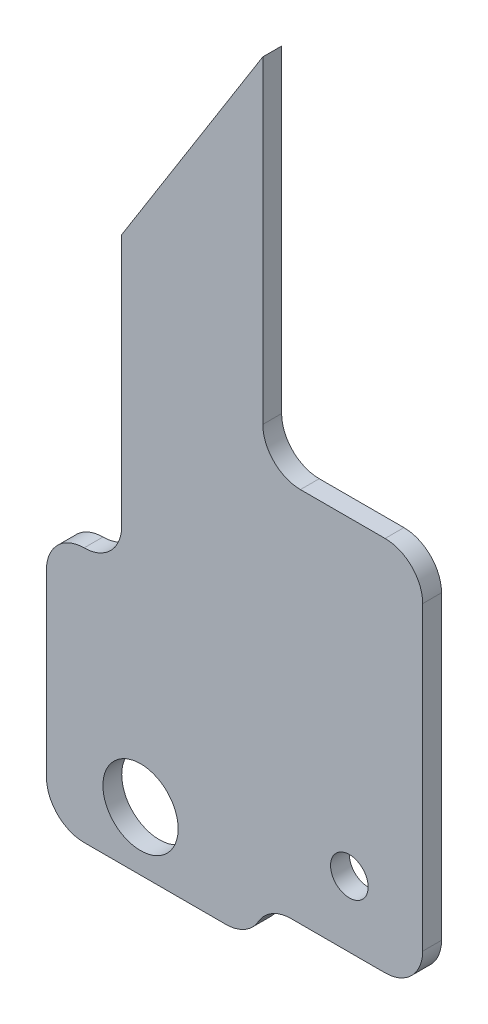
SolidWorks part; units mm, degrees
ref_plane "Płaszczyzna przednia" through (0, 0, 0) normal (0, 0, 1) x (1, 0, 0)
ref_plane "Płaszczyzna górna" through (0, 0, 0) normal (0, 1, 0) x (1, 0, 0)
ref_plane "Płaszczyzna prawa" through (0, 0, 0) normal (1, 0, 0) x (0, 0, -1)
sketch "Szkic1" plane through (0, 0, 0) normal (0, 0, 1) x (1, 0, 0)
  line L0 (-13.6488, -23.1321) -> (4.3512, -23.1321)
  line L1 (4.3512, -23.1321) -> (4.3512, 16.8679)
  line L2 (-13.6488, -23.1321) -> (-13.6488, -52.8735)
  line L3 (-13.6488, -52.8735) -> (-35.6488, -52.8735)
  line L4 (-35.6488, -52.8735) -> (-35.6488, 0)
  line L5 (-35.6488, 0) -> (-27.6488, 0)
  line L6 (-27.6488, 0) -> (-27.6488, 30.8429)
  line L7 (-27.6488, 30.8429) -> (-12.6488, 54.7094)
  line L8 (4.3512, 16.8679) -> (-12.6488, 16.8679)
  line L9 (-12.6488, 16.8679) -> (-12.6488, 54.7094)
  dimension "D1" = 107.5828
  dimension "D2" = 40
  dimension "D3" = 17
  dimension "D4" = 40
  dimension "D5" = 22
  dimension "D6" = 15
extrude "Dodanie-wyciągnięcie1" add sketch "Szkic1" along normal blind 2
hole_wizard "Otwory ustalające Ø4.0mm1" positions "Szkic3" profile "Szkic2" hole size "Ø4.0" standard "Ansi Metric"
sketch "Szkic3" plane through (0, 0, 2) normal (0, 0, 1) x (1, 0, 0)
  line L0 (4.3512, -23.1321) -> (4.3512, 16.8679) construction
  line L2 (-13.6488, -23.1321) -> (4.3512, -23.1321) construction
  point P0 (-3.4488, -16.1321)
  dimension "D1" = 7.8
  dimension "D2" = 7
sketch "Szkic2" plane through (-3.4488, -16.1321, 2) normal (1, 0, 0) x (0, -1, 0)
  line L0 (0, 0) -> (0, 11.2017)
  line L1 (0, 11.2017) -> (2, 10)
  line L2 (2, 10) -> (2, 0)
  line L5 (2, 0) -> (0, 0)
  line L10 (0, 11.2017) -> (-2, 10) construction
  line L11 (0, -6.35) -> (0, 107.95) construction
  dimension "Średnica otworu" = 4
  dimension "Głębokość otworu" = 10
  dimension "Kąt wiertła" = 118
hole_wizard "Otwory ustalające Ø8.0mm1" positions "Szkic5" profile "Szkic4" hole size "Ø8.0" standard "Ansi Metric"
sketch "Szkic5" plane through (0, 0, 2) normal (0, 0, 1) x (1, 0, 0)
  line L0 (-35.6488, 0) -> (-35.6488, -52.8735) construction
  line L1 (-35.6488, -52.8735) -> (-13.6488, -52.8735) construction
  point P0 (-25.6488, -20.8735)
  dimension "D1" = 10
  dimension "D2" = 32
sketch "Szkic4" plane through (-25.6488, -20.8735, 2) normal (1, 0, 0) x (0, -1, 0)
  line L0 (0, 0) -> (0, 12.4034)
  line L1 (0, 12.4034) -> (4, 10)
  line L2 (4, 10) -> (4, 0)
  line L5 (4, 0) -> (0, 0)
  line L10 (0, 12.4034) -> (-4, 10) construction
  line L11 (0, -6.35) -> (0, 107.95) construction
  dimension "Średnica otworu" = 8
  dimension "Głębokość otworu" = 10
  dimension "Kąt wiertła" = 118
fillet "Zaokrąglenie1" radius 4 8 edges at (-12.6488, 16.8679, 1) (4.3512, 16.8679, 1) (4.3512, -23.1321, 1) (-13.6488, -23.1321, 1) (-13.6488, -52.8735, 1) (-35.6488, -52.8735, 1) (-27.6488, 0, 1) (-35.6488, 0, 1)
sketch "Szkic7" plane through (0, 0, 2) normal (0, 0, 1) x (1, 0, 0)
  line L0 (-13.6488, -27.1321) -> (-35.6488, -27.1321)
  line L1 (-35.6488, -4) -> (-35.6488, -48.8735) construction
  line L2 (-35.6488, -27.1321) -> (-35.6488, -48.8735)
  line L3 (-31.6488, -52.8735) -> (-17.6488, -52.8735)
  line L4 (-13.6488, -48.8735) -> (-13.6488, -27.1321)
  arc A0 (-35.6488, -48.8735) -> (-31.6488, -52.8735) centre (-31.6488, -48.8735) ccw
  arc A1 (-17.6488, -52.8735) -> (-13.6488, -48.8735) centre (-17.6488, -48.8735) ccw
extrude "Wytnij-wyciągnięcie1" cut sketch "Szkic7" against normal through all
fillet "Zaokrąglenie2" radius 4 2 edges at (-13.6488, -27.1321, 1) (-35.6488, -27.1321, 1)
